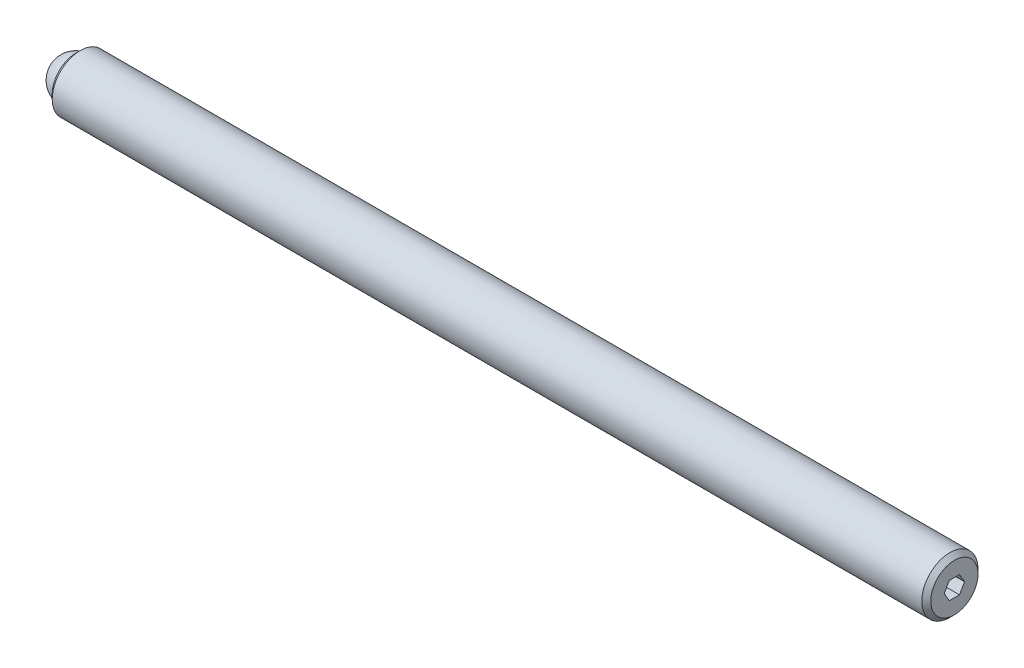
SolidWorks part; units mm, degrees
ref_plane "Front Plane" through (0, 0, 0) normal (0, 0, 1) x (1, 0, 0)
ref_plane "Top Plane" through (0, 0, 0) normal (0, 1, 0) x (1, 0, 0)
ref_plane "Right Plane" through (0, 0, 0) normal (1, 0, 0) x (0, 0, -1)
sketch "Sketch2" plane through (0, 0, 0) normal (1, 0, 0) x (0, 0, -1)
  circle A0 centre (0, 0) radius 3.175
  dimension "D1" = 6.35
extrude "Boss-Extrude1" add sketch "Sketch2" along normal blind 99.2188
sketch "Sketch3" plane through (0, 0, 0) normal (-1, 0, 0) x (0, 0, 1)
  circle A0 centre (0, 0) radius 2.3813
  dimension "D1" = 4.7625
chamfer "Chamfer1" distance 0.508 angle 45 1 edges at (0, 0, -3.175)
chamfer "Chamfer2" distance 0.508 angle 45 1 edges at (99.2188, 0, -3.175)
sketch "Sketch4" plane through (99.2188, 0, 0) normal (1, 0, 0) x (0, 0, -1)
  line L1 (1.1457, 0) -> (0.5728, 0.9922)
  line L2 (0.5728, 0.9922) -> (-0.5728, 0.9922)
  line L3 (-0.5728, 0.9922) -> (-1.1457, 0)
  line L4 (-1.1457, 0) -> (-0.5728, -0.9922)
  line L5 (-0.5728, -0.9922) -> (0.5728, -0.9922)
  line L6 (0.5728, -0.9922) -> (1.1457, 0)
  circle A0 centre (0, 0) radius 0.9922 construction
  dimension "D1" = 1.9844
extrude "Cut-Extrude2" cut sketch "Sketch4" against normal blind 2.286
extrude "Cut-Extrude3" cut sketch "Sketch3" against normal blind 1.9844
sketch "Sketch5" plane through (0, 0, 0) normal (-1, 0, 0) x (0, 0, 1)
  line L0 (0, 0) -> (0, -2.3813)
  line L1 (0, 0) -> (0, 2.3813)
  arc A0 (0, 2.3813) -> (0, -2.3813) centre (0, 0) ccw
  dimension "D1" = 2.3813
revolve "Revolve1" add sketch "Sketch5" angle 360 about L1
